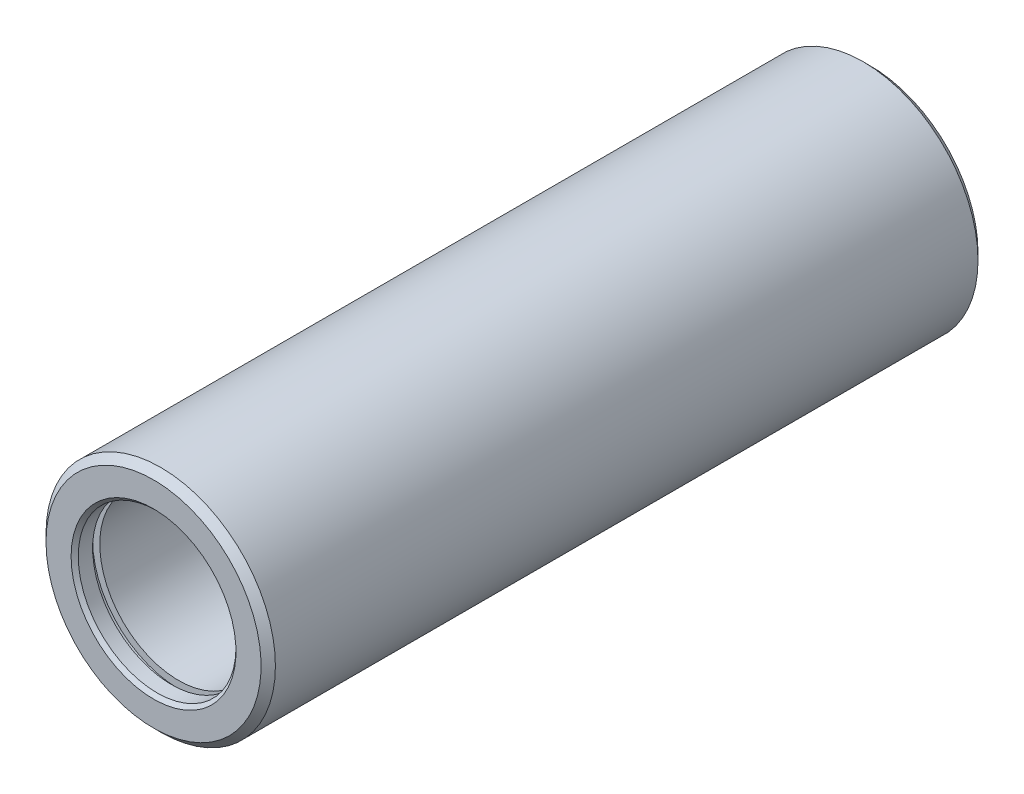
SolidWorks part; units mm, degrees
ref_plane "Front Plane" through (0, 0, 0) normal (0, 0, 1) x (1, 0, 0)
ref_plane "Top Plane" through (0, 0, 0) normal (0, 1, 0) x (1, 0, 0)
ref_plane "Right Plane" through (0, 0, 0) normal (1, 0, 0) x (0, 0, -1)
sketch "Sketch1" plane through (0, 0, 0) normal (0, 1, 0) x (1, 0, 0)
  line L0 (0, 0) -> (0, 100) construction
  line L1 (-11, 100) -> (-16, 100)
  line L2 (-16, 100) -> (-16, 0)
  line L3 (-11, 26.5) -> (-11, 3.5)
  line L4 (-11, 2.5) -> (-11, 0)
  line L5 (-12, 27.5) -> (-11, 27.5)
  line L6 (-12, 30) -> (-12, 70)
  line L7 (-12, 70) -> (-11, 70)
  line L8 (-11, 70) -> (-11, 72.5)
  line L9 (0, 50) -> (-16, 50) construction
  line L10 (-11, 97.5) -> (-12, 97.5)
  line L11 (-12, 97.5) -> (-12, 96.5)
  line L12 (-12, 96.5) -> (-11, 96.5)
  line L13 (-11, 73.5) -> (-12, 73.5)
  line L14 (-12, 73.5) -> (-12, 72.5)
  line L15 (-12, 72.5) -> (-11, 72.5)
  line L16 (-11, 97.5) -> (-11, 100)
  line L17 (-11, 73.5) -> (-11, 96.5)
  line L18 (-12, 26.5) -> (-12, 27.5)
  line L19 (-11, 26.5) -> (-12, 26.5)
  line L20 (-12, 3.5) -> (-11, 3.5)
  line L21 (-12, 2.5) -> (-12, 3.5)
  line L22 (-11, 2.5) -> (-12, 2.5)
  line L23 (-11, 30) -> (-11, 27.5)
  line L24 (-12, 30) -> (-11, 30)
  line L25 (-11, 0) -> (-16, 0)
  dimension "D1" = 100
  dimension "D2" = 32
  dimension "D4" = 24
  dimension "D5" = 22
  dimension "D6" = 30
  dimension "D8" = 1
  dimension "D9" = 1
  dimension "D10" = 1
  dimension "D11" = 1
  dimension "D12" = 2.5
  dimension "D13" = 2.5
revolve "Revolve1" add sketch "Sketch1" angle 360 about L0
chamfer "Chamfer1" distance 1 angle 45 2 edges at (16, 0, -100) (16, 0, 0)
chamfer "Chamfer3" distance 0.5 angle 45 2 edges at (12, 0, -70) (12, 0, -30)
chamfer "Chamfer4" distance 0.5 angle 45 4 edges at (11, 0, -100) (11, 0, -70) (11, 0, -30) (11, 0, 0)
